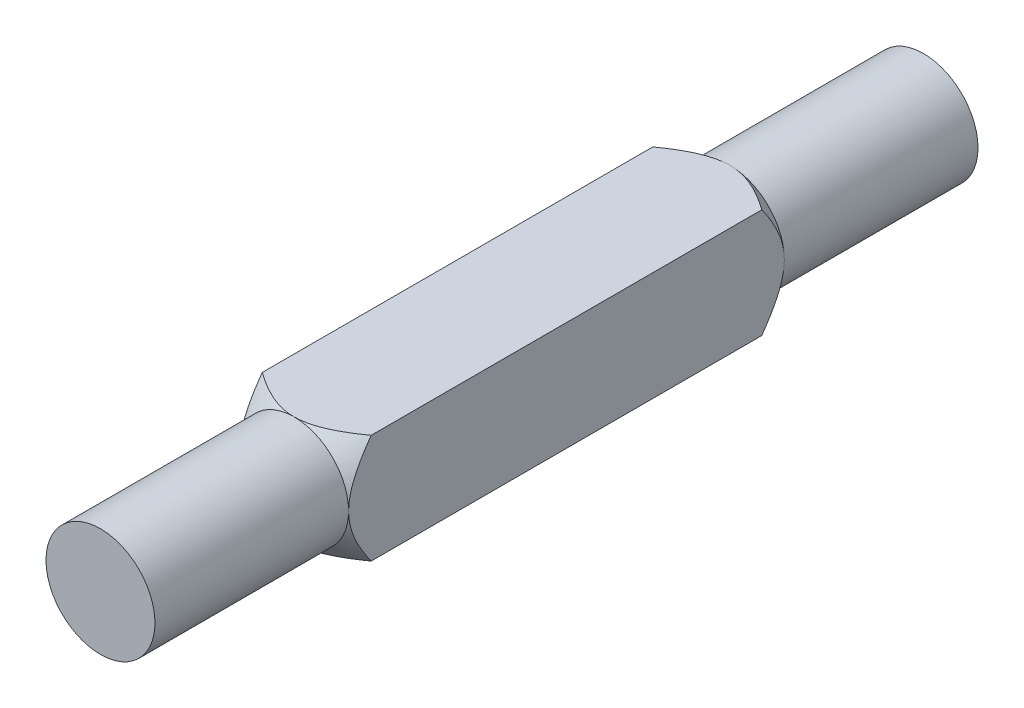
SolidWorks part; units mm, degrees
ref_plane "Front" through (0, 0, 0) normal (0, 0, 1) x (1, 0, 0)
ref_plane "Top" through (0, 0, 0) normal (0, 1, 0) x (1, 0, 0)
ref_plane "Right" through (0, 0, 0) normal (1, 0, 0) x (0, 0, -1)
sketch "Sketch1" plane through (0, 0, 0) normal (0, 0, 1) x (1, 0, 0)
  line L0 (0, 0) -> (0, 4.5) construction
  line L1 (-4.5, -4.5) -> (4.5, -4.5)
  line L2 (-4.5, -4.5) -> (-4.5, 4.5)
  line L3 (-4.5, 4.5) -> (4.5, 4.5)
  line L4 (4.5, -4.5) -> (4.5, 4.5)
  line L5 (0, 0) -> (4.5, 0) construction
  dimension "D1" = 9
extrude "Extrude1" add sketch "Sketch1" along normal blind 34
ref_plane "Plane1" through (0, 0, 36) normal (0, 0, 1) x (1, 0, 0)
mirror "Mirror19" about plane through (-4.5, 4.5, 0) normal (0, 0, -1) of "Extrude1"
sketch "Sketch3" plane through (0, 0, 0) normal (1, 0, 0) x (0, 0, -1)
  line L0 (-34, 4.5) -> (-18, 4.5)
  line L1 (-34, 4.5) -> (-34, -4.5) construction
  line L2 (-18, 4.5) -> (-13, 9.5)
  line L4 (-34, 9.5) -> (-34, 4.5)
  line L5 (-34, 9.5) -> (-13, 9.5)
  line L6 (-34, 0) -> (-45.3557, 0) construction
  dimension "D1" = 16
  dimension "D2" = 5
  dimension "D3" = 135
  dimension "D4" = 4.5
revolve "Cut-Revolve1" cut sketch "Sketch3" angle 360 about L6
mirror "Mirror20" about plane through (0, 0, 0) normal (0, 0, 1) of "Cut-Revolve1"
